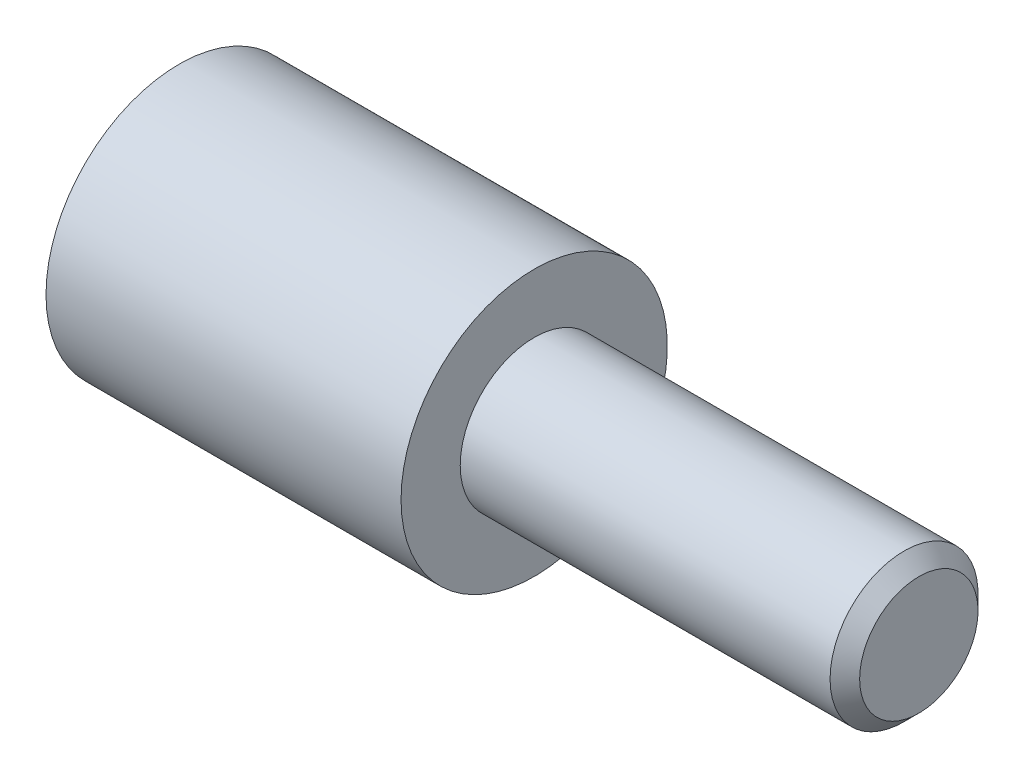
SolidWorks part; units mm, degrees
ref_plane "Plan de face" through (0, 0, 0) normal (0, 0, 1) x (1, 0, 0)
ref_plane "Plan de dessus" through (0, 0, 0) normal (0, 1, 0) x (1, 0, 0)
ref_plane "Plan de droite" through (0, 0, 0) normal (1, 0, 0) x (0, 0, -1)
sketch "Esquisse1" plane through (0, 0, 0) normal (0, 0, 1) x (1, 0, 0)
  line L0 (0, 2.8) -> (0, 4.5)
  line L1 (0, 4.5) -> (12, 4.5)
  line L2 (12, 4.5) -> (12, 2.5)
  line L3 (12, 2.5) -> (25, 2.5)
  line L4 (25, 2.5) -> (25, 0)
  line L5 (25, 0) -> (10, 0)
  line L6 (10, 0) -> (10, 2.8)
  line L7 (10, 2.8) -> (0, 2.8)
  line L8 (-11.7052, 0) -> (36.8676, 0) construction
  dimension "D1" = 2.8
  dimension "D2" = 10
  dimension "D3" = 12
  dimension "D4" = 4.5
  dimension "D5" = 2.5
  dimension "D6" = 13
revolve "Révolution1" add sketch "Esquisse1" angle 360 about L8
chamfer "Chanfrein1" distance 0.5 angle 45 1 edges at (25, 0, 2.5)
